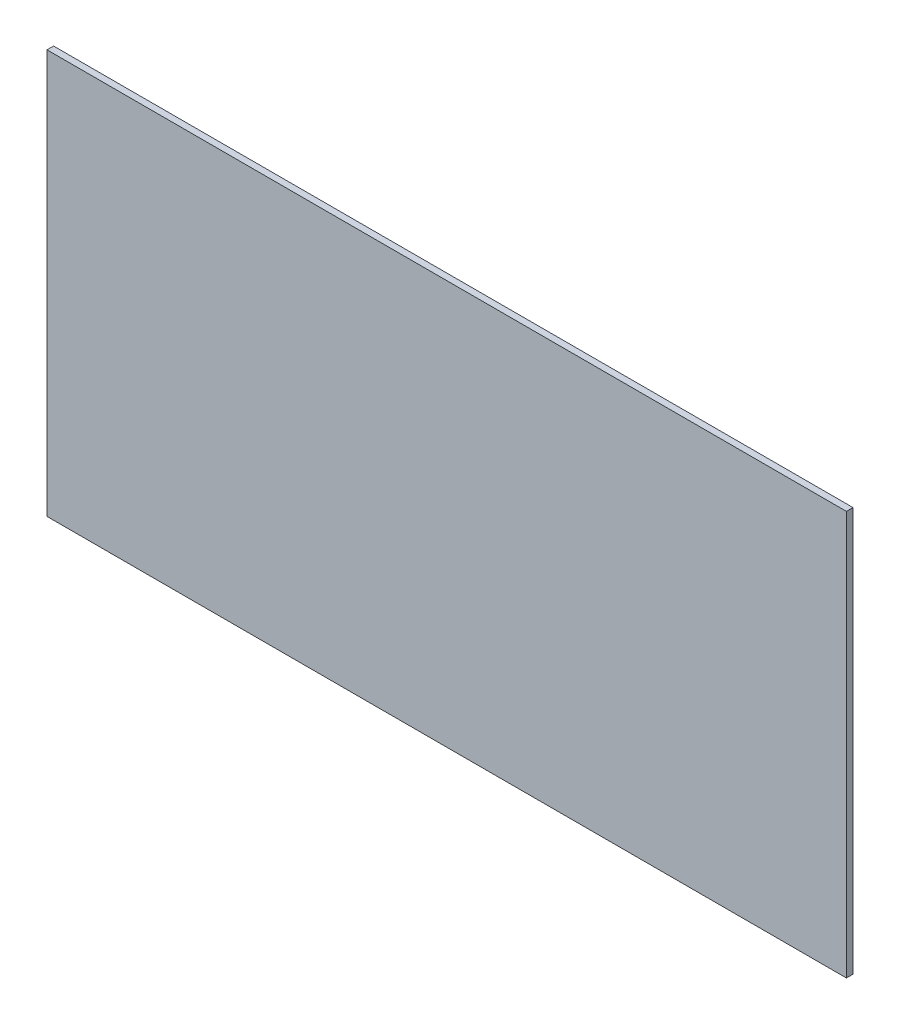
SolidWorks part; units mm, degrees
ref_plane "Plan de face" through (0, 0, 0) normal (0, 0, 1) x (1, 0, 0)
ref_plane "Plan de dessus" through (0, 0, 0) normal (0, 1, 0) x (1, 0, 0)
ref_plane "Plan de droite" through (0, 0, 0) normal (1, 0, 0) x (0, 0, -1)
sketch "Esquisse1" plane through (0, 0, 0) normal (0, 0, 1) x (1, 0, 0)
  line L1 (0, 0) -> (364, 0)
  line L2 (0, 0) -> (0, 184)
  line L3 (0, 184) -> (364, 184)
  line L4 (364, 0) -> (364, 184)
extrude "Extrusion1" add sketch "Esquisse1" along normal blind 3
